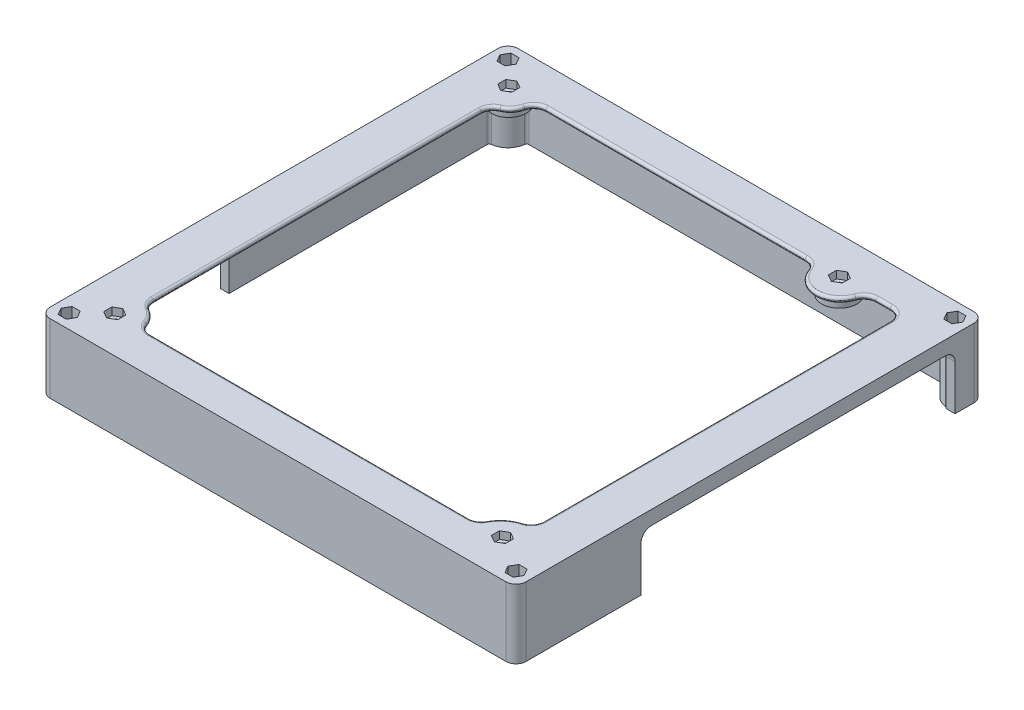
SolidWorks part; units mm, degrees
ref_plane "Front Plane" through (0, 0, 0) normal (0, 0, 1) x (1, 0, 0)
ref_plane "Top Plane" through (0, 0, 0) normal (0, 1, 0) x (1, 0, 0)
ref_plane "Right Plane" through (0, 0, 0) normal (1, 0, 0) x (0, 0, -1)
sketch "Sketch1" plane through (0, 0, 0) normal (0, 1, 0) x (1, 0, 0)
  line L0 (0, 0) -> (-77.46, 0) construction
  line L1 (-77.46, 0) -> (-77.46, 78.74) construction
  line L2 (-77.46, 0) -> (-77.46, -78.74) construction
  line L3 (0, 0) -> (54.62, 0) construction
  line L4 (54.62, 0) -> (54.62, 78.74) construction
  line L5 (77.46, 0) -> (77.46, -78.74) construction
  line L6 (54.62, 0) -> (77.46, 0) construction
  circle A0 centre (-77.46, 78.74) radius 5
  circle A1 centre (-77.46, -78.74) radius 5
  circle A2 centre (77.46, -78.74) radius 5
  circle A3 centre (54.62, 78.74) radius 5
  circle A4 centre (-77.46, 78.74) radius 1.5
  circle A5 centre (-77.46, -78.74) radius 1.5
  circle A6 centre (77.46, -78.74) radius 1.5
  circle A7 centre (54.62, 78.74) radius 1.5
  dimension "D5" = 10
  dimension "D6" = 3
  dimension "D1" = 78.74
  dimension "D2" = 77.46
  dimension "D3" = 77.46
  dimension "D4" = 22.84
extrude "Boss-Extrude1" add sketch "Sketch1" against normal blind 3
sketch "Sketch2" plane through (0, 0, 0) normal (0, 1, 0) x (1, 0, 0)
  line L0 (-77.46, 78.74) -> (-77.46, -78.74) construction
  line L1 (-77.46, -78.74) -> (77.46, -78.74) construction
  line L2 (0, 0) -> (111.5, 0) construction
  line L3 (0, 0) -> (0, 111.5) construction
  point P4 (0, 0)
  dimension "D1" = 111.5
sketch "Sketch4" plane through (0, 0, 0) normal (0, 1, 0) x (1, 0, 0)
  line L0 (77.46, -78.74) -> (-77.46, -78.74) construction
  line L1 (-77.46, -78.74) -> (-77.46, 78.74) construction
  line L2 (-77.46, 78.74) -> (54.62, 78.74) construction
  line L4 (97.64, -93.49) -> (-92.54, -93.49)
  line L5 (97.64, -93.49) -> (97.64, 93.49)
  line L6 (97.64, 93.49) -> (-92.54, 93.49)
  line L7 (-92.54, -93.49) -> (-92.54, 93.49)
  dimension "D1" = 20.18
  dimension "D2" = 15.08
  dimension "D3" = 14.75
  dimension "D4" = 14.75
extrude "Boss-Extrude2" add sketch "Sketch4" along normal blind 2
sketch "Sketch5" plane through (0, 0, 0) normal (0, -1, 0) x (1, 0, 0)
  line L15 (-92.54, -93.49) -> (-92.54, 93.49) construction
  line L20 (-89.04, -89.99) -> (94.14, -89.99)
  line L21 (-89.04, -89.99) -> (-89.04, 89.99)
  line L22 (-89.04, 89.99) -> (94.14, 89.99)
  line L23 (94.14, -89.99) -> (94.14, 89.99)
  line L24 (97.64, -93.49) -> (-92.54, -93.49) construction
  line L25 (97.64, 93.49) -> (97.64, -93.49) construction
  line L26 (-92.54, 93.49) -> (97.64, 93.49) construction
  line L28 (-92.54, -93.49) -> (97.64, -93.49)
  line L29 (-92.54, -93.49) -> (-92.54, 93.49)
  line L30 (-92.54, 93.49) -> (97.64, 93.49)
  line L31 (97.64, -93.49) -> (97.64, 93.49)
  dimension "D1" = 3.5
  dimension "D2" = 3.5
  dimension "D3" = 3.5
  dimension "D4" = 3.5
extrude "Boss-Extrude3" add sketch "Sketch5" along normal blind 3.58
sketch "Sketch7" plane through (0, 0, 0) normal (1, 0, 0) x (0, 0, -1)
  line L0 (0, 0) -> (0, -50.0007) construction
sketch "Sketch13" plane through (0, 2, 0) normal (0, 1, 0) x (1, 0, 0)
  line L0 (97.64, 93.49) -> (97.64, -93.49) construction
  line L1 (-74.66, 80.3566) -> (-77.46, 81.9732)
  line L2 (-77.46, 81.9732) -> (-80.26, 80.3566)
  line L3 (-80.26, 80.3566) -> (-80.26, 77.1234)
  line L4 (-80.26, 77.1234) -> (-77.46, 75.5068)
  line L5 (-77.46, 75.5068) -> (-74.66, 77.1234)
  line L6 (-74.66, 77.1234) -> (-74.66, 80.3566)
  line L7 (54.62, 81.9732) -> (51.82, 80.3566)
  line L8 (51.82, 80.3566) -> (51.82, 77.1234)
  line L9 (51.82, 77.1234) -> (54.62, 75.5068)
  line L10 (54.62, 75.5068) -> (57.42, 77.1234)
  line L11 (57.42, 77.1234) -> (57.42, 80.3566)
  line L12 (57.42, 80.3566) -> (54.62, 81.9732)
  line L13 (77.46, -75.5068) -> (74.66, -77.1234)
  line L14 (74.66, -77.1234) -> (74.66, -80.3566)
  line L15 (74.66, -80.3566) -> (77.46, -81.9732)
  line L16 (77.46, -81.9732) -> (80.26, -80.3566)
  line L17 (80.26, -80.3566) -> (80.26, -77.1234)
  line L18 (80.26, -77.1234) -> (77.46, -75.5068)
  line L19 (-77.46, -75.5068) -> (-80.26, -77.1234)
  line L20 (-80.26, -77.1234) -> (-80.26, -80.3566)
  line L21 (-80.26, -80.3566) -> (-77.46, -81.9732)
  line L22 (-77.46, -81.9732) -> (-74.66, -80.3566)
  line L23 (-74.66, -80.3566) -> (-74.66, -77.1234)
  line L24 (-74.66, -77.1234) -> (-77.46, -75.5068)
  circle A0 centre (-77.46, 78.74) radius 2.8 construction
  circle A1 centre (54.62, 78.74) radius 2.8 construction
  circle A2 centre (77.46, -78.74) radius 2.8 construction
  circle A3 centre (-77.46, -78.74) radius 2.8 construction
  dimension "D1" = 5.6
extrude "Cut-Extrude8" cut sketch "Sketch13" against normal blind 3
sketch "Sketch15" plane through (0, 0, 0) normal (0, -1, 0) x (1, 0, 0)
  circle A0 centre (-77.46, 78.74) radius 7
  circle A1 centre (-77.46, 78.74) radius 5
  circle A2 centre (77.46, 78.74) radius 7
  circle A3 centre (77.46, 78.74) radius 5
  circle A4 centre (54.62, -78.74) radius 7
  circle A5 centre (54.62, -78.74) radius 5
  circle A6 centre (-77.46, -78.74) radius 7
  circle A7 centre (-77.46, -78.74) radius 5
  dimension "D1" = 10
  dimension "D2" = 14
extrude "Boss-Extrude4" add sketch "Sketch15" along normal blind 4
sketch "Sketch18" plane through (0, -3.58, 0) normal (0, -1, 0) x (1, 0, 0)
  line L0 (94.14, -81.99) -> (97.64, -81.99)
  line L1 (97.64, -93.49) -> (-92.54, -93.49)
  line L2 (97.64, -93.49) -> (97.64, -81.99)
  line L3 (97.64, 93.49) -> (-92.54, 93.49)
  line L4 (-92.54, -93.49) -> (-92.54, 21.49)
  line L5 (-89.04, 89.99) -> (94.14, 89.99)
  line L6 (-89.04, 89.99) -> (-89.04, 71.49)
  line L7 (-89.04, -89.99) -> (94.14, -89.99)
  line L16 (94.14, 89.99) -> (94.14, 43.49)
  line L17 (94.14, 43.49) -> (97.64, 43.49)
  line L18 (97.64, 43.49) -> (97.64, 93.49)
  line L19 (94.14, -81.99) -> (94.14, -89.99)
  line L20 (-89.04, 71.49) -> (-92.54, 71.49)
  line L22 (-92.54, 21.49) -> (-89.04, 21.49)
  line L23 (-89.04, 21.49) -> (-89.04, -89.99)
  line L24 (-92.54, 71.49) -> (-92.54, 93.49)
  point P16 (-90.79, 71.49)
  dimension "D1" = 50
  dimension "D2" = 11.5
  dimension "D3" = 22
  dimension "D4" = 50
extrude "Boss-Extrude6" add sketch "Sketch18" along normal blind 22
sketch "Sketch20" plane through (0, -25.58, 0) normal (0, -1, 0) x (1, 0, 0)
  line L0 (-92.54, 21.49) -> (-92.54, -93.49) construction
  line L1 (-92.54, -93.49) -> (97.64, -93.49) construction
  line L4 (-92.54, 0) -> (128.4829, 0) construction
  line L7 (2.55, -93.49) -> (2.55, 93.49) construction
  line L8 (97.64, 93.49) -> (-92.54, 93.49) construction
  line L13 (-92.54, -93.49) -> (-82.6063, -93.8446)
  line L14 (-92.54, -93.49) -> (-92.3221, -83.2463)
  line L15 (-92.54, 93.49) -> (-92.3221, 83.2463)
  line L16 (-92.54, 93.49) -> (-82.6063, 93.8446)
  line L17 (97.64, 93.49) -> (87.7063, 93.8446)
  line L18 (97.64, 93.49) -> (97.4221, 83.2463)
  line L19 (97.64, -93.49) -> (97.4221, -83.2463)
  line L20 (97.64, -93.49) -> (87.7063, -93.8446)
  arc A4 (-82.6063, -93.8446) -> (-92.3221, -83.2463) centre (-89.04, -89.99) ccw
  arc A5 (-82.6063, 93.8446) -> (-92.3221, 83.2463) centre (-89.04, 89.99) cw
  arc A6 (87.7063, 93.8446) -> (97.4221, 83.2463) centre (94.14, 89.99) ccw
  arc A7 (87.7063, -93.8446) -> (97.4221, -83.2463) centre (94.14, -89.99) cw
  dimension "D1" = 15
extrude "Boss-Extrude7" add sketch "Sketch20" against normal up to next
sketch "Sketch21" plane through (0, -25.58, 0) normal (0, -1, 0) x (1, 0, 0)
  line L0 (-83.7367, -84.6867) -> (-92.54, -93.49) construction
  line L1 (-92.54, -93.49) -> (-86.7367, -93.49) construction
  line L2 (-92.54, -93.49) -> (-92.54, -87.6867) construction
  line L3 (-92.54, -87.6867) -> (-86.7367, -87.6867) construction
  line L4 (-86.7367, -93.49) -> (-86.7367, -87.6867) construction
  line L5 (2.55, -93.49) -> (2.55, 93.49) construction
  line L6 (-92.54, -93.49) -> (97.64, -93.49) construction
  line L7 (97.64, 93.49) -> (-92.54, 93.49) construction
  line L8 (2.55, 0) -> (-92.54, 0) construction
  line L9 (-92.54, 21.49) -> (-92.54, -93.49) construction
  arc A0 (-81.54, -89.99) -> (-89.04, -82.49) centre (-89.04, -89.99) ccw construction
  circle A1 centre (-86.7367, -87.6867) radius 1.55
  circle A2 centre (-86.7367, 87.6867) radius 1.55
  circle A3 centre (91.8367, -87.6867) radius 1.55
  circle A4 centre (91.8367, 87.6867) radius 1.55
  dimension "D2" = 3.1
  dimension "D1" = 3
extrude "Cut-Extrude9" cut sketch "Sketch21" against normal through all
sketch "Sketch22" plane through (0, 2, 0) normal (0, 1, 0) x (1, 0, 0)
  line L1 (90.2201, 84.8867) -> (93.4533, 84.8867)
  line L2 (93.4533, 84.8867) -> (95.0699, 87.6867)
  line L3 (95.0699, 87.6867) -> (93.4533, 90.4867)
  line L4 (93.4533, 90.4867) -> (90.2201, 90.4867)
  line L5 (90.2201, 90.4867) -> (88.6035, 87.6867)
  line L6 (88.6035, 87.6867) -> (90.2201, 84.8867)
  line L7 (97.64, 93.49) -> (-92.54, 93.49) construction
  line L8 (97.64, 0) -> (-92.54, 0) construction
  line L9 (97.64, -93.49) -> (97.64, 93.49) construction
  line L10 (-92.54, 93.49) -> (-92.54, -93.49) construction
  line L11 (2.55, 93.49) -> (2.55, -93.49) construction
  line L12 (-92.54, -93.49) -> (97.64, -93.49) construction
  line L13 (88.6035, -87.6867) -> (90.2201, -84.8867)
  line L14 (90.2201, -90.4867) -> (88.6035, -87.6867)
  line L15 (93.4533, -90.4867) -> (90.2201, -90.4867)
  line L16 (95.0699, -87.6867) -> (93.4533, -90.4867)
  line L17 (93.4533, -84.8867) -> (95.0699, -87.6867)
  line L18 (90.2201, -84.8867) -> (93.4533, -84.8867)
  line L19 (-83.5035, 87.6867) -> (-85.1201, 84.8867)
  line L20 (-85.1201, 90.4867) -> (-83.5035, 87.6867)
  line L21 (-88.3533, 90.4867) -> (-85.1201, 90.4867)
  line L22 (-89.9699, 87.6867) -> (-88.3533, 90.4867)
  line L23 (-88.3533, 84.8867) -> (-89.9699, 87.6867)
  line L24 (-85.1201, 84.8867) -> (-88.3533, 84.8867)
  line L25 (-85.1201, -90.4867) -> (-83.5035, -87.6867)
  line L26 (-88.3533, -90.4867) -> (-85.1201, -90.4867)
  line L27 (-89.9699, -87.6867) -> (-88.3533, -90.4867)
  line L28 (-88.3533, -84.8867) -> (-89.9699, -87.6867)
  line L29 (-85.1201, -84.8867) -> (-88.3533, -84.8867)
  line L30 (-83.5035, -87.6867) -> (-85.1201, -84.8867)
  circle A0 centre (91.8367, 87.6867) radius 2.8 construction
  dimension "D1" = 5.6
extrude "Cut-Extrude10" cut sketch "Sketch22" against normal blind 21.58
fillet "Fillet5" radius 4 8 edges at (-90.79, -3.58, 71.49) (-90.79, -3.58, 21.49) (95.89, -3.58, 43.49) (-92.54, -11.79, 93.49) (97.64, -11.79, 93.49) (97.64, -11.79, -93.49) (-92.54, -11.79, -93.49) (95.89, -3.58, -81.99)
sketch "Sketch23" plane through (0, 0, 0) normal (0, -1, 0) x (1, 0, 0)
  line L0 (80.01, -78.74) -> (65.105, -78.74)
  line L1 (80.01, -78.74) -> (80.01, 69.0706)
  line L2 (67.46, 78.74) -> (-67.46, 78.74)
  line L3 (-74.91, 69.0706) -> (-74.91, -69.0706)
  line L4 (45.105, -78.74) -> (-67.46, -78.74)
  line L5 (-81.54, -89.99) -> (86.64, -89.99) construction
  line L6 (94.14, -82.49) -> (94.14, 82.49) construction
  line L7 (86.64, 89.99) -> (-81.54, 89.99) construction
  line L8 (-89.04, 82.49) -> (-89.04, -82.49) construction
  arc A0 (80.01, 69.0706) -> (67.46, 78.74) centre (80.01, 82.0497) cw
  arc A2 (45.105, -78.74) -> (65.105, -78.74) centre (55.105, -78.74) cw
  arc A3 (-74.91, -69.0706) -> (-67.46, -78.74) centre (-74.91, -76.7753) cw
  arc A4 (-67.46, 78.74) -> (-74.91, 69.0706) centre (-77.46, 78.74) cw
  dimension "D5" = 10
  dimension "D6" = 10
  dimension "D1" = 11.25
  dimension "D2" = 14.13
  dimension "D3" = 11.25
  dimension "D4" = 14.13
  dimension "D7" = 10
  dimension "D8" = 10
  dimension "D9" = 10
  dimension "D10" = 10
  dimension "D11" = 10
extrude "Cut-Extrude11" cut sketch "Sketch23" against normal through all
fillet "Fillet6" radius 5 9 edges at (80.01, 1, -78.74) (-67.46, 1, -78.74) (-74.91, 1, -69.0706) (-67.46, 1, 78.74) (-74.91, 1, 69.0706) (67.46, 1, 78.74) (80.01, 1, 69.0706) (45.105, 1, -78.74) (65.105, 1, -78.74)
fillet "Fillet7" radius 2 12 edges at (77.46, 0, 85.74) (54.62, 0, -71.74) (-77.46, 0, -71.74) (-77.46, 0, 85.74) (88.8367, 0, -84.6867) (2.55, 0, -89.99) (-83.7367, 0, -84.6867) (-83.7367, 0, 84.6867) (-89.04, 0, 0) (88.8367, 0, 84.6867) (94.14, 0, 0) (2.55, 0, 89.99)
fillet "Fillet8" radius 1 54 edges at (-65.6576, 0, -77.6753) (-69.0359, 0, -71.7896) (-74.0837, 0, -67.8491) (-74.91, 0, 0.3414) (-74.2449, 0, 68.2703) (-69.7577, 0, 72.3624) (-66.2046, 0, 77.8225) (0.3743, 0, 78.74) (66.6593, 0, 78.0152) (75.6694, 0, 69.8179) (69.0776, 0, 75.054) (79.007, 0, 67.7838) (80.01, 0, -4.4801) (78.5455, 0, -77.2755) (72.1286, 0, -78.74) (66.3604, 0, -77.8225) (55.105, 0, -68.74) (43.8496, 0, -77.8225) (-65.6576, 2, -77.6753) (-69.0359, 2, -71.7896) (-74.0837, 2, -67.8491) (-74.91, 2, 0.3414) (-74.2449, 2, 68.2703) (-69.7577, 2, 72.3624) (-66.2046, 2, 77.8225) (0.3743, 2, 78.74) (66.6593, 2, 78.0152) (71.7877, 2, 72.0073) (79.007, 2, 67.7838) (80.01, 2, -4.4801) (78.5455, 2, -77.2755) (72.1286, 2, -78.74) (66.3604, 2, -77.8225) (55.105, 2, -68.74) (43.8496, 2, -77.8225) (-10.8052, 0, -78.74) (-10.8052, 2, -78.74) (86.3812, -1.0082, 89.7268) (93.8768, -1.0082, 82.2312) (-88.7768, -1.0082, 82.2312) (-81.2812, -1.0082, 89.7268) (93.8768, -1.0082, -82.2312) (86.3812, -1.0082, -89.7268) (-88.7768, -1.0082, -82.2312) (-81.2812, -1.0082, -89.7268) (86.64, -13.79, 89.99) (94.14, -13.79, 82.49) (-89.04, -13.79, 82.49) (-81.54, -13.79, 89.99) (94.14, -13.79, -82.49) (86.64, -13.79, -89.99) (-89.04, -13.79, -82.49) (-81.54, -13.79, -89.99) (72.0885, 0, 71.7683)
